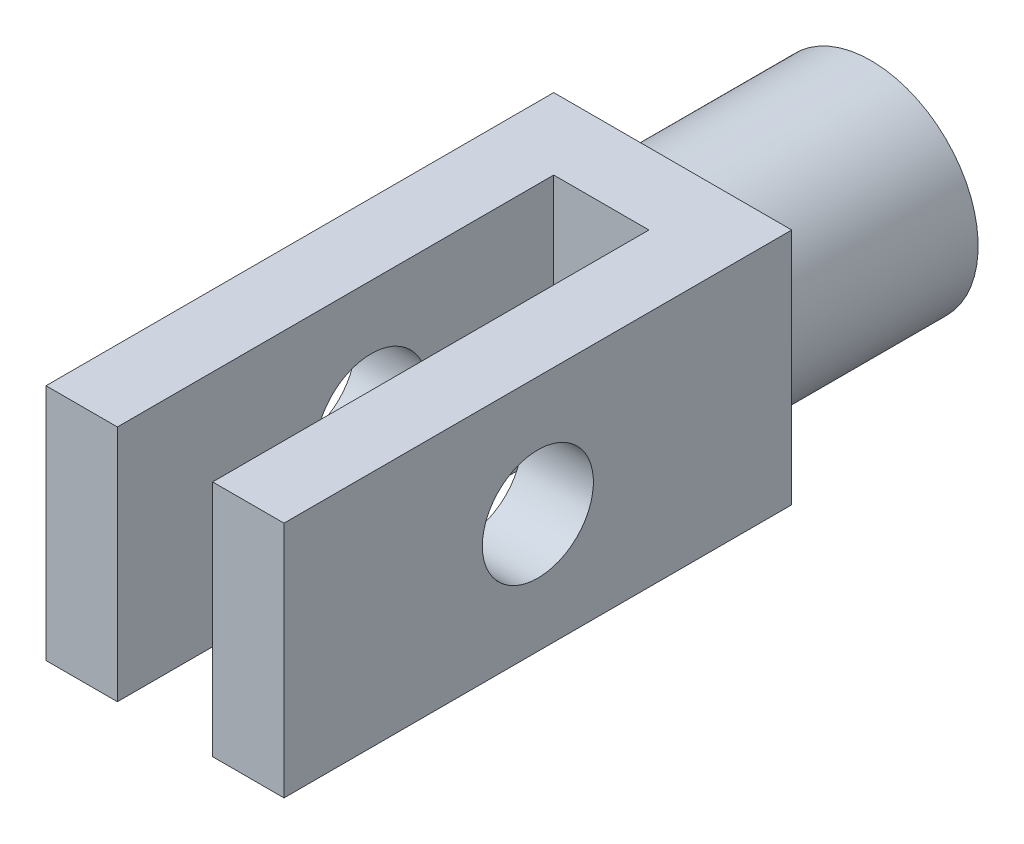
SolidWorks part; units mm, degrees
ref_plane "Front" through (0, 0, 0) normal (0, 0, 1) x (1, 0, 0)
ref_plane "Top" through (0, 0, 0) normal (0, 1, 0) x (1, 0, 0)
ref_plane "Right" through (0, 0, 0) normal (1, 0, 0) x (0, 0, -1)
sketch "Sketch1" plane through (0, 0, 0) normal (0, 0, 1) x (1, 0, 0)
  line L1 (-15, -15) -> (15, -15)
  line L2 (-15, -15) -> (-15, 15)
  line L3 (-15, 15) -> (15, 15)
  line L4 (15, -15) -> (15, 15)
  line L5 (-15, -15) -> (15, 15) construction
  line L6 (-15, 15) -> (15, -15) construction
  point P0 (0, 0)
  dimension "D1" = 30
  dimension "D2" = 30
extrude "Boss-Extrude1" add sketch "Sketch1" along normal blind 9
sketch "Sketch2" plane through (0, 0, 9) normal (0, 0, 1) x (1, 0, 0)
  line L0 (-15, -15) -> (15, -15) construction
  line L1 (-15, 15) -> (-6, 15)
  line L2 (-15, 15) -> (-15, -15)
  line L3 (-15, -15) -> (-6, -15)
  line L4 (-6, 15) -> (-6, -15)
  line L6 (15, 15) -> (6, 15)
  line L7 (15, 15) -> (15, -15)
  line L8 (15, -15) -> (6, -15)
  line L9 (6, 15) -> (6, -15)
  dimension "D1" = 9
  dimension "D2" = 9
extrude "Boss-Extrude2" add sketch "Sketch2" along normal blind 55
sketch "Sketch3" plane through (0, 0, 0) normal (0, 0, -1) x (-1, 0, 0)
  circle A0 centre (0, 0) radius 13.5
  dimension "D1" = 27
extrude "Boss-Extrude3" add sketch "Sketch3" along normal blind 25
sketch "Sketch4" plane through (0, 0, -25) normal (0, 0, -1) x (-1, 0, 0)
  circle A0 centre (0, 0) radius 8
  dimension "D1" = 16
extrude "Cut-Extrude1" cut sketch "Sketch4" against normal blind 25
sketch "Sketch5" plane through (-15, 0, 0) normal (-1, 0, 0) x (0, 0, 1)
  circle A0 centre (32, 0) radius 7
  dimension "D1" = 14
extrude "Cut-Extrude2" cut sketch "Sketch5" against normal through all
